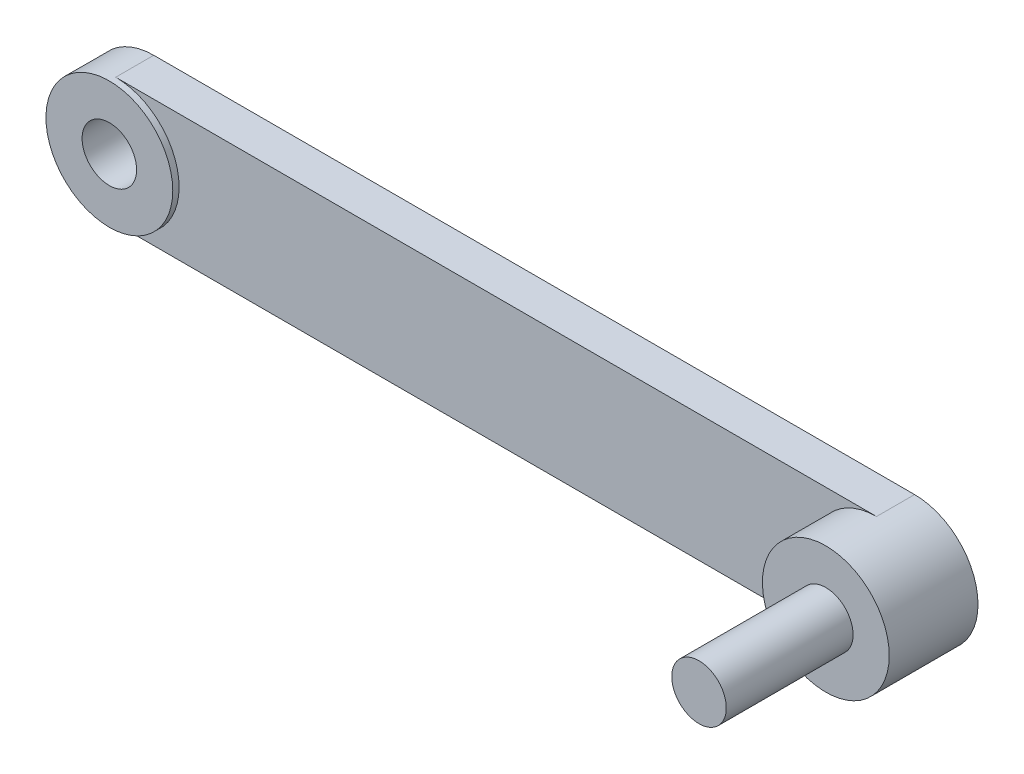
SolidWorks part; units mm, degrees
ref_plane "Plan de face" through (0, 0, 0) normal (0, 0, 1) x (1, 0, 0)
ref_plane "Plan de dessus" through (0, 0, 0) normal (0, 1, 0) x (1, 0, 0)
ref_plane "Plan de droite" through (0, 0, 0) normal (1, 0, 0) x (0, 0, -1)
sketch "Esquisse1" plane through (0, 0, 0) normal (0, 0, 1) x (1, 0, 0)
  line L0 (0, 0) -> (60, 0) construction
  line L1 (0, 5) -> (60, 5)
  line L2 (0, -5) -> (60, -5)
  arc A0 (0, 5) -> (0, -5) centre (0, 0) ccw
  arc A1 (60, -5) -> (60, 5) centre (60, 0) ccw
  circle A2 centre (0, 0) radius 2.15
  circle A3 centre (60, 0) radius 2.15
  point P3 (30, 0)
extrude "Boss.-Extru.1" add sketch "Esquisse1" along normal blind 3
sketch "Esquisse2" plane through (0, 0, 3) normal (0, 0, 1) x (1, 0, 0)
  line L0 (0, -5) -> (60, -5) construction
  circle A0 centre (0, 0) radius 5
  circle A1 centre (0, 0) radius 2.15
  circle A2 centre (60, 0) radius 2.05
  circle A3 centre (60, 0) radius 5
  circle A4 centre (0, 0) radius 2.15 construction
extrude "Boss.-Extru.2" add sketch "Esquisse2" along normal blind 0.5
sketch "Esquisse3" plane through (0, 0, 3.5) normal (0, 0, 1) x (1, 0, 0)
  circle A0 centre (0, 0) radius 5.1172
sketch "Esquisse4" plane through (0, 0, 3.5) normal (0, 0, 1) x (1, 0, 0)
  circle A0 centre (60, 0) radius 2.05 construction
  circle A1 centre (60, 0) radius 5
  circle A2 centre (60, 0) radius 5
  circle A3 centre (60, 0) radius 2.05
  dimension "D1" = 0
extrude "Boss.-Extru.3" add sketch "Esquisse4" along normal blind 3.5
sketch "Esquisse5" plane through (0, 0, 0) normal (0, 0, -1) x (-1, 0, 0)
  circle A0 centre (-60, 0) radius 2.15 construction
  circle A1 centre (-60, 0) radius 2.15
extrude "Boss.-Extru.4" add sketch "Esquisse5" against normal blind 17
equation "\"D4@Esquisse1\"=\"D3@Esquisse1\""
